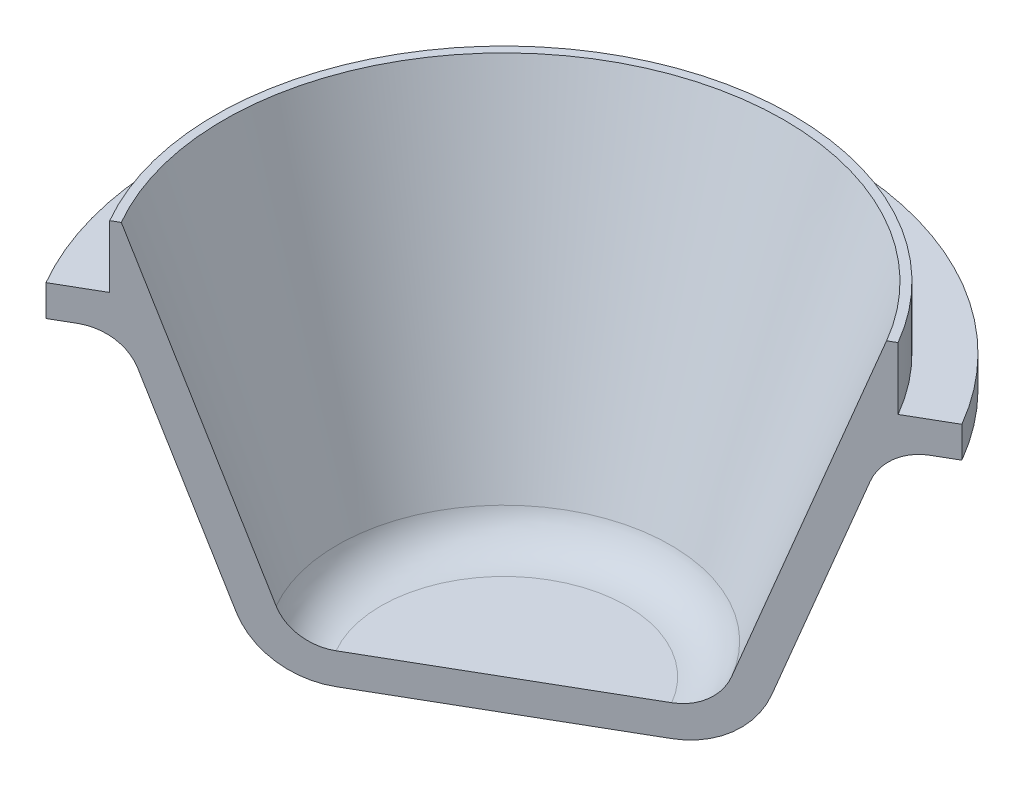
SolidWorks part; units mm, degrees
ref_plane "Front Plane" through (0, 0, 0) normal (0, 0, 1) x (1, 0, 0)
ref_plane "Top Plane" through (0, 0, 0) normal (0, 1, 0) x (1, 0, 0)
ref_plane "Right Plane" through (0, 0, 0) normal (1, 0, 0) x (0, 0, -1)
sketch "Sketch1" plane through (0, 0, 0) normal (0, 0, 1) x (1, 0, 0)
  line L0 (-5.7757, 9) -> (-3.2757, 9)
  line L1 (-3.2757, 9) -> (-0.3592, 0.987)
  line L2 (1.0503, 0) -> (5, 0)
  line L3 (5, 0) -> (5, -1)
  line L4 (5, -1) -> (1.0503, -1)
  line L5 (-1.2989, 0.6449) -> (-3.6167, 7.013)
  line L6 (-5.0263, 8) -> (-5.7757, 8)
  line L7 (-5.7757, 8) -> (-5.7757, 9)
  line L8 (5, -1) -> (5, 11.0331) construction
  arc A0 (-3.6167, 7.013) -> (-5.0263, 8) centre (-5.0263, 6.5) ccw
  arc A1 (-0.3592, 0.987) -> (1.0503, 0) centre (1.0503, 1.5) ccw
  arc A3 (1.0503, -1) -> (-1.2989, 0.6449) centre (1.0503, 1.5) cw
  point P14 (0, 0)
  point P17 (-3.2757, 9)
  dimension "D8" = 1.5
  dimension "D9" = 2.5
  dimension "D1" = 1
  dimension "D2" = 5
  dimension "D3" = 110
  dimension "D4" = 1
  dimension "D5" = 1
  dimension "D6" = 2.5
  dimension "D7" = 10
revolve "Revolve1" add sketch "Sketch1" angle 150 about L8
other "Lip4" parameters "LipHeight"=2, "LipWidth"=1, "LipDraftAngle"=0, "D4"=0, "D5"=0, "D6"=2, "D7"=1, "D8"=0, "D9"=0
